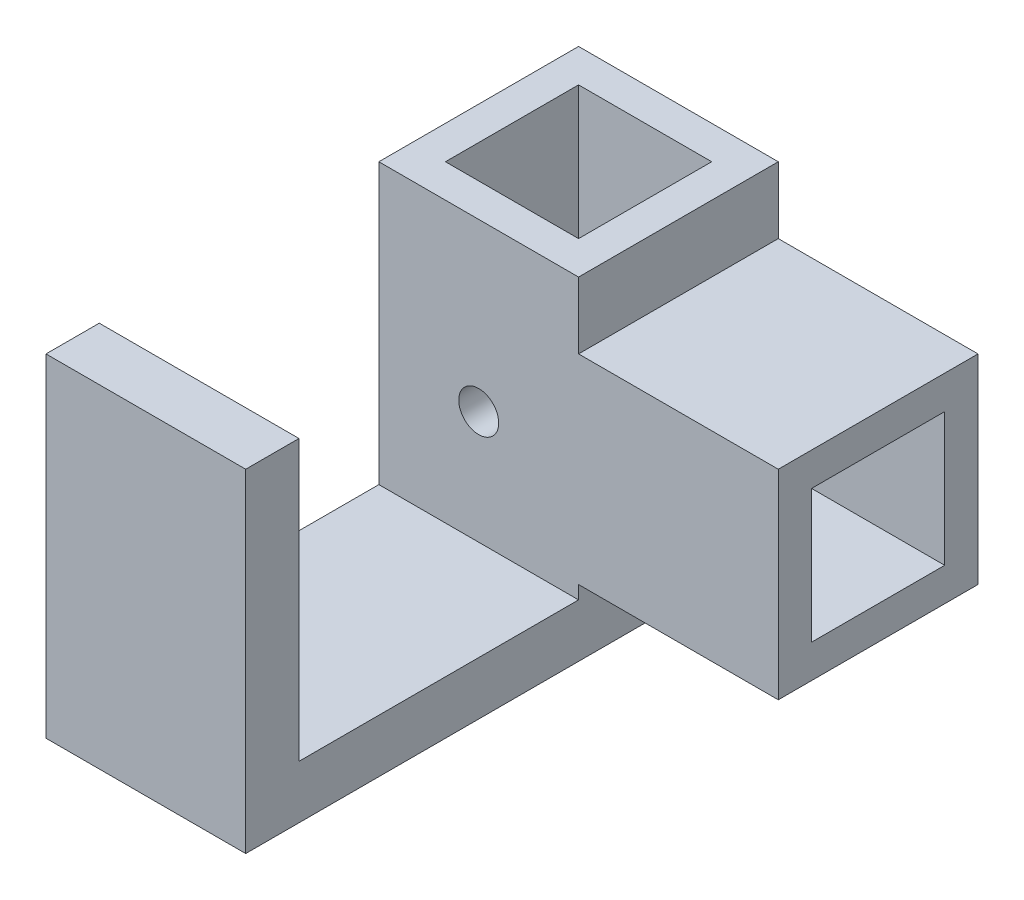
SolidWorks part; units mm, degrees
ref_plane "Alzado" through (0, 0, 0) normal (0, 0, 1) x (1, 0, 0)
ref_plane "Planta" through (0, 0, 0) normal (0, 1, 0) x (1, 0, 0)
ref_plane "Vista lateral" through (0, 0, 0) normal (1, 0, 0) x (0, 0, -1)
sketch "Sketch1" plane through (0, 0, 0) normal (0, 0, 1) x (1, 0, 0)
  line L0 (15, 15) -> (15, 25)
  line L1 (-15, -25) -> (15, -25)
  line L2 (-15, -25) -> (-15, 25)
  line L3 (-15, 25) -> (15, 25)
  line L4 (15, -25) -> (15, -15)
  line L5 (-15, -25) -> (15, 25) construction
  line L6 (-15, 25) -> (15, -25) construction
  line L7 (15, 15) -> (45, 15)
  line L9 (15, -15) -> (45, -15)
  line L10 (45, 15) -> (45, -15)
  circle A0 centre (0, 0) radius 3
  point P0 (0, 0)
  point P10 (45, 0)
  dimension "D5" = 6
  dimension "D1" = 30
  dimension "D2" = 50
  dimension "D3" = 45
  dimension "D4" = 30
extrude "Boss-Extrude1" add sketch "Sketch1" along normal mid plane 30
sketch "Sketch2" plane through (0, 25, 0) normal (0, 1, 0) x (1, 0, 0)
  line L8 (10, 10) -> (-10, 10)
  line L9 (-10, 10) -> (-10, -10)
  line L10 (-10, -10) -> (10, -10)
  line L11 (10, -10) -> (10, 10)
  line L12 (10, 10) -> (-10, 10)
  line L13 (-10, 10) -> (-10, -10)
  line L14 (-10, -10) -> (10, -10)
  line L15 (10, -10) -> (10, 10)
  dimension "D1" = 5
extrude "Cut-Extrude1" cut sketch "Sketch2" against normal blind 59
sketch "Sketch3" plane through (45, 0, 0) normal (1, 0, 0) x (0, 0, -1)
  line L8 (10, -10) -> (10, 10)
  line L9 (10, 10) -> (-10, 10)
  line L10 (-10, 10) -> (-10, -10)
  line L11 (-10, -10) -> (10, -10)
  line L12 (10, -10) -> (10, 10)
  line L13 (10, 10) -> (-10, 10)
  line L14 (-10, 10) -> (-10, -10)
  line L15 (-10, -10) -> (10, -10)
  dimension "D1" = 5
extrude "Cut-Extrude2" cut sketch "Sketch3" against normal blind 25
sketch "Sketch4" plane through (-10, 0, 0) normal (1, 0, 0) x (0, 0, -1)
  line L10 (0, 0) -> (0, 25) construction
  line L11 (-15, 25) -> (15, 25) construction
  line L12 (-57, 25) -> (-57, -17) construction
  line L13 (-15, -17) -> (-57, -17) construction
  line L14 (-15, 25) -> (-15, -17) construction
  line L15 (-15, 25) -> (-57, 25) construction
  line L16 (-57, 25) -> (-65, 25)
  line L17 (-15, -25) -> (-15, -17)
  line L18 (-65, -25) -> (-65, 25)
  line L19 (-15, -25) -> (-65, -25)
  line L20 (-57, -17) -> (-57, 25)
  line L21 (-15, -17) -> (-57, -17)
extrude "Boss-Extrude2" add sketch "Sketch4" along normal blind 25 and the other way blind 5
